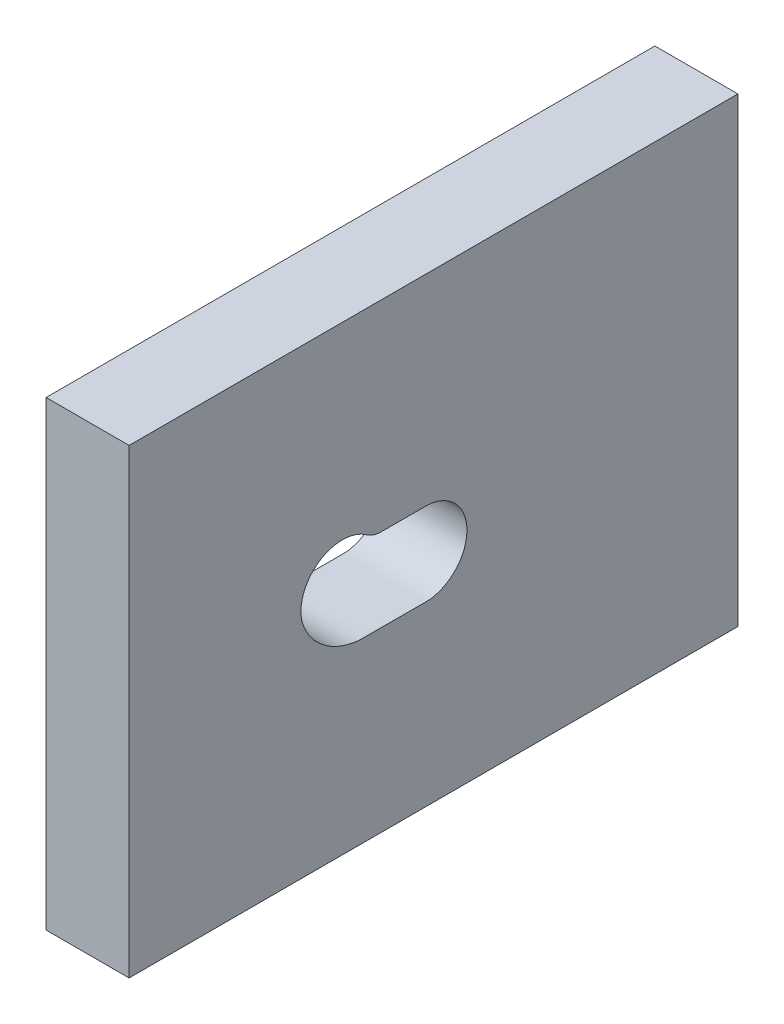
SolidWorks part; units mm, degrees
ref_plane "Front Plane" through (0, 0, 0) normal (0, 0, 1) x (1, 0, 0)
ref_plane "Top Plane" through (0, 0, 0) normal (0, 1, 0) x (1, 0, 0)
ref_plane "Right Plane" through (0, 0, 0) normal (1, 0, 0) x (0, 0, -1)
sketch "Sketch1" plane through (0, 0, 0) normal (1, 0, 0) x (0, 0, -1)
  line L0 (10.6726, 0) -> (0, 0) construction
  line L1 (10.6726, 10) -> (0, 10) construction
  line L2 (10.6726, -10) -> (-4, -10) construction
  line L4 (-60.7218, 58.4004) -> (85.9508, 58.4004)
  line L5 (-60.7218, 58.4004) -> (-60.7218, -52.727)
  line L6 (-60.7218, -52.727) -> (85.9508, -52.727)
  line L7 (85.9508, 58.4004) -> (85.9508, -52.727)
  arc A0 (0, 0) -> (-9.3274, 3) centre (0, 16) cw construction
  arc A1 (0, 10) -> (-3.4978, 11.125) centre (0, 16) cw construction
  arc A2 (-4, -10) -> (-17.8783, -2.1847) centre (-4, 6.2302) cw construction
  arc A3 (10.6726, 10) -> (10.6726, -10) centre (10.6726, 0) cw construction
  arc A4 (-3.4978, 11.125) -> (-17.8783, -2.1847) centre (-9.3274, 3) ccw construction
  spline S0 degree 3 number of poles 71 (13.3765, 9.6275) -> (13.3765, 9.6275)
  dimension "D2" = 6
  dimension "D1" = 3
  dimension "D3" = 20
  dimension "D4" = 20
  dimension "D5" = 4
extrude "Extrude1" add sketch "Sketch1" along normal blind 20
